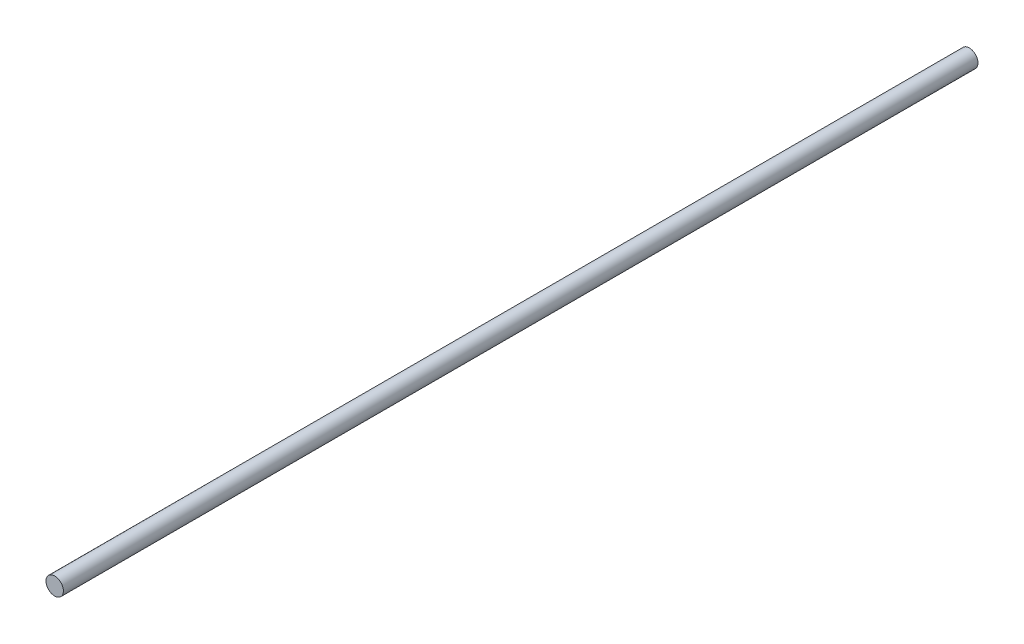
SolidWorks part; units mm, degrees
ref_plane "Front Plane" through (0, 0, 0) normal (0, 0, 1) x (1, 0, 0)
ref_plane "Top Plane" through (0, 0, 0) normal (0, 1, 0) x (1, 0, 0)
ref_plane "Right Plane" through (0, 0, 0) normal (1, 0, 0) x (0, 0, -1)
sketch "Sketch1" plane through (0, 0, 0) normal (0, 0, 1) x (1, 0, 0)
  circle A0 centre (0, 0) radius 30
  dimension "D1" = 60
extrude "Boss-Extrude1" add sketch "Sketch1" against normal blind 3150
